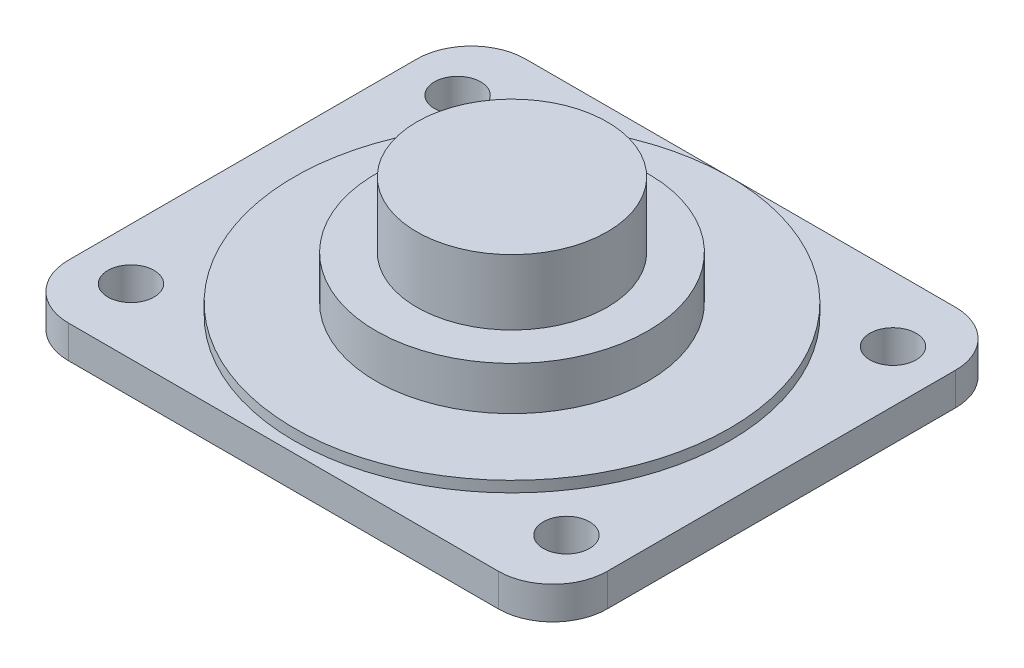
SolidWorks part; units mm, degrees
ref_plane "Plan de face" through (0, 0, 0) normal (0, 0, 1) x (1, 0, 0)
ref_plane "Plan de dessus" through (0, 0, 0) normal (0, 1, 0) x (1, 0, 0)
ref_plane "Plan de droite" through (0, 0, 0) normal (1, 0, 0) x (0, 0, -1)
sketch "Esquisse1" plane through (0, 0, 0) normal (0, 1, 0) x (1, 0, 0)
  line L1 (-39.5, 42) -> (39.5, 42)
  line L2 (-49.5, 32) -> (-49.5, -32)
  line L3 (-39.5, -42) -> (39.5, -42)
  line L4 (49.5, 32) -> (49.5, -32)
  arc A0 (-39.5, 42) -> (-49.5, 32) centre (-39.5, 32) ccw
  arc A1 (39.5, -42) -> (49.5, -32) centre (39.5, -32) ccw
  arc A2 (39.5, 42) -> (49.5, 32) centre (39.5, 32) cw
  arc A3 (-49.5, -32) -> (-39.5, -42) centre (-39.5, -32) ccw
  circle A4 centre (-40, 30) radius 4.25
  circle A5 centre (40, 30) radius 4.25
  circle A6 centre (40, -30) radius 4.25
  circle A7 centre (-40, -30) radius 4.25
  point P6 (-49.5, 42)
  point P11 (49.5, 42)
  point P14 (-49.5, -42)
  dimension "D5" = 10
  dimension "D6" = 8.5
  dimension "D7" = 8.5
  dimension "D8" = 8.5
  dimension "D9" = 8.5
  dimension "D1" = 99
  dimension "D2" = 84
  dimension "D3" = 49.5
  dimension "D4" = 42
  dimension "D10" = 30
  dimension "D11" = 30
  dimension "D12" = 40
  dimension "D13" = 40
extrude "Extrusion1" add sketch "Esquisse1" along normal blind 6
sketch "Esquisse3" plane through (0, 0, 0) normal (0, 0, 1) x (1, 0, 0)
  line L0 (0, 6) -> (0, 28)
  line L1 (-39.5, 6) -> (39.5, 6) construction
  line L2 (0, 28) -> (17.5, 28)
  line L3 (17.5, 28) -> (17.5, 16)
  line L4 (17.5, 16) -> (25, 16)
  line L5 (25, 16) -> (25, 8)
  line L6 (25, 8) -> (40, 8)
  line L7 (40, 8) -> (40, 6)
  line L8 (0, 6) -> (40, 6)
  line L9 (-39.5, 0) -> (39.5, 0) construction
  dimension "D1" = 28
  dimension "D2" = 12
  dimension "D3" = 8
  dimension "D4" = 17.5
  dimension "D5" = 25
  dimension "D6" = 40
revolve "Révolution1" add sketch "Esquisse3" angle 360 about L0
